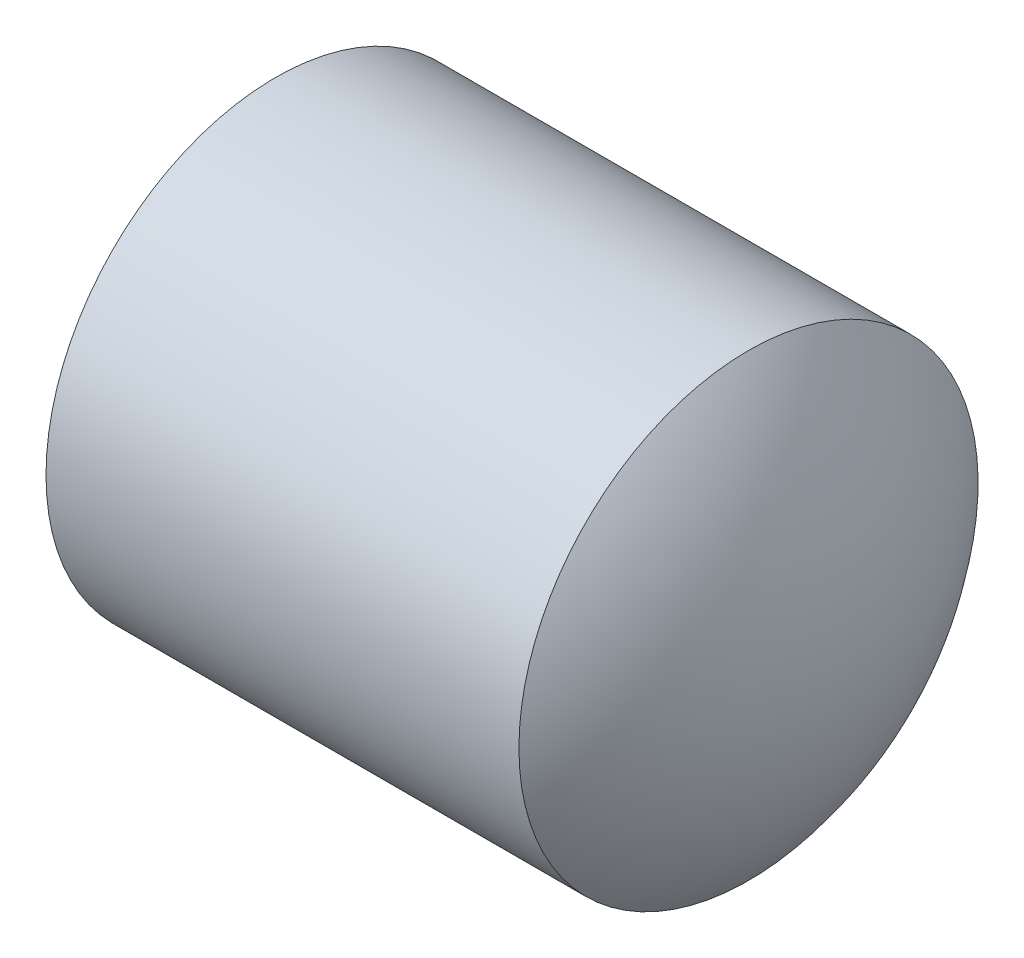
SolidWorks part; units mm, degrees
ref_plane "Plane1" through (0, 0, 0) normal (0, 0, 1) x (1, 0, 0)
ref_plane "Plane2" through (0, 0, 0) normal (0, 1, 0) x (1, 0, 0)
ref_plane "Plane3" through (0, 0, 0) normal (1, 0, 0) x (0, 0, -1)
sketch "BodySke" plane through (0, 0, 0) normal (0, 0, 1) x (1, 0, 0)
  line L0 (0, 0) -> (0, 10.352)
  line L1 (0, 10.352) -> (0.9515, 12)
  line L2 (0.9515, 12) -> (25.672, 12)
  line L3 (3, 15.875) -> (3, -3.175) construction
  line L4 (30, 0) -> (0, 0)
  line L5 (-12.7, 0) -> (88.9, 0) construction
  line L8 (0, -10.352) -> (0.9515, -12) construction
  arc A0 (30, 0) -> (25.672, 12) centre (11.2, 0) ccw
  dimension "Oval_radius" = 18.8
  dimension "Length" = 30
  dimension "Diameter" = 24
  dimension "Drive_ch_ang" = 60
  dimension "Minor_dia" = 20.704
  dimension "Advance" = 3
revolve "BaseBody" add sketch "BodySke" angle 360 about L5
sketch "Sketch2" plane through (0, 0, 0) normal (-1, 0, 0) x (0, 0, 1)
  line L0 (3.4641, 6) -> (-3.4641, 6)
  line L1 (-3.4641, 6) -> (-6.9282, 0)
  line L2 (3.4641, 6) -> (6.9282, 0)
  line L3 (3.4641, -6) -> (6.9282, 0)
  line L4 (3.4641, -6) -> (-3.4641, -6)
  line L5 (-3.4641, -6) -> (-6.9282, 0)
  dimension "Hex_size" = 12
  dimension "D2" = 6
  dimension "D3" = 6
extrude "Hex" cut sketch "Sketch2" against normal blind 12
sketch "Sketch4" plane through (0, 4.7709, -0.5249) normal (-1, 0, 0) x (0, 0, 1)
  line L0 (0.5249, -4.7709) -> (10.6976, -4.7709)
  line L1 (0.5249, -4.7709) -> (6.6732, -1.2211) construction
  line L2 (0.5249, -4.7709) -> (5.6112, 4.0389)
  line L3 (8.9666, -2.6687) -> (10.2861, -1.9069)
  line L4 (6.5663, 1.4888) -> (7.8858, 2.2506)
  arc A0 (8.9666, -2.6687) -> (6.5663, 1.4888) centre (0.5249, -4.7709) ccw
  arc A1 (10.6976, -4.7709) -> (10.2861, -1.9069) centre (0.5249, -4.7709) ccw
  arc A2 (5.6112, 4.0389) -> (7.8858, 2.2506) centre (0.5249, -4.7709) cw
  circle A3 centre (0.5249, -4.7709) radius 8.6995 construction
  circle A4 centre (0.5249, -4.7709) radius 10.1727 construction
  dimension "D1" = 30
  dimension "Spline_n_dim" = 17.399
  dimension "Spline_m_dim" = 20.3454
  dimension "Spline_a_dim" = 60
  dimension "D3" = 2.4003
  dimension "Spline_p_dim" = 4.8006
extrude "Spline6" [suppressed] cut sketch "Sketch4" against normal blind 12
pattern_circular "CirPattern1" [suppressed] count 6 every 60 about axis through (-12.7, 0, 0) along (1, 0, 0)
sketch "Sketch5" plane through (0, -2.3417, -0.7053) normal (-1, 0, 0) x (0, 0, 1)
  line L0 (0.7053, 2.3417) -> (10.878, 2.3417)
  line L1 (0.7053, 2.3417) -> (5.7254, 7.3618) construction
  line L2 (0.7053, 2.3417) -> (0.7053, 12.5144)
  line L3 (8.554, 6.7959) -> (9.3926, 7.6345)
  line L4 (5.1595, 10.1904) -> (5.9981, 11.029)
  line L5 (5.1595, 10.1904) -> (8.554, 6.7959)
  arc A1 (10.878, 2.3417) -> (9.3926, 7.6345) centre (0.7053, 2.3417) ccw
  arc A2 (0.7053, 12.5144) -> (5.9981, 11.029) centre (0.7053, 2.3417) cw
  circle A3 centre (0.7053, 2.3417) radius 8.6995 construction
  circle A4 centre (0.7053, 2.3417) radius 10.1727 construction
  dimension "D1" = 45
  dimension "Spline_n_dim" = 17.399
  dimension "Spline_m_dim" = 20.3454
  dimension "Spline_a_dim" = 90
  dimension "D3" = 2.4003
  dimension "Spline_p_dim" = 4.8006
extrude "Spline4" [suppressed] cut sketch "Sketch5" against normal blind 12
pattern_circular "CirPattern2" [suppressed] count 4 every 90 about axis through (-12.7, 0, 0) along (1, 0, 0)
sketch "ThdSchSke" plane through (0, 0, 0) normal (0, 0, 1) x (1, 0, 0)
  line L0 (0.9515, -10.352) -> (-0.2025, -12)
  line L1 (0.9515, -10.352) -> (2.1054, -12)
  line L2 (2.1054, -12) -> (2.1054, -15)
  line L3 (-3.175, 0) -> (5.1513, 0) construction
  line L4 (0.9515, 12) -> (0.9515, -12) construction
  line L5 (2.1054, -15) -> (-0.2025, -15)
  line L6 (-0.2025, -15) -> (-0.2025, -12)
  dimension "Thread_minor" = 20.704
  dimension "Diameter" = 24
  dimension "SideAngle" = 55
  dimension "VeeAngle" = 70
  dimension "Overcut" = 30
revolve "ThreadSchematic" [suppressed] cut sketch "ThdSchSke" angle 360 about L3
pattern_linear "ThdSchPat" [suppressed]
equation "\"D2@Sketch2\" = \"Hex_size@Sketch2\" / 2"
equation "\"D3@Sketch2\" = \"Hex_size@Sketch2\" / 2"
equation "\"Thread_minor@ThreadCosmetic\" = \"Minor_dia@BodySke\""
equation "\"D1@Sketch4\" = \"Spline_a_dim@Sketch4\" / 2"
equation "\"D3@Sketch4\" = \"Spline_p_dim@Sketch4\" / 2"
equation "\"D2@CirPattern1\" = \"Spline_a_dim@Sketch4\""
equation "\"Num_teeth@CirPattern1\" = 360 / \"D2@CirPattern1\""
equation "\"Spline_a_dim@Sketch5\" = 90"
equation "\"Spline_p_dim@Sketch5\" = \"Spline_p_dim@Sketch4\""
equation "\"Spline_m_dim@Sketch5\" = \"Spline_m_dim@Sketch4\""
equation "\"Spline_n_dim@Sketch5\" = \"Spline_n_dim@Sketch4\""
equation "\"D1@Sketch5\" = \"Spline_a_dim@Sketch5\" / 2"
equation "\"D3@Sketch5\" = \"Spline_p_dim@Sketch5\" / 2"
equation "\"Key_eng@Spline4\" = \"Key_eng@Spline6\""
equation "\"Thread_minor@ThdSchSke\" = \"Thread_minor@ThreadCosmetic\""
equation "\"Diameter@ThdSchSke\" = \"Diameter@BodySke\""
equation "\"Overcut@ThdSchSke\" = \"Diameter@BodySke\" * 1.25"
equation "\"Num_threads@ThdSchPat\" = int( (\"Length@BodySke\" - ( ( ( \"Diameter@BodySke\" - \"Minor_dia@BodySke\" ) * 0.5 ) / tan( \"Drive_ch_ang@BodySke\" * 0.017453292 ) ) - ( \"Oval_radius@BodySke\" - sqr ( ( \"Oval_ra"
equation "\"Advance@ThdSchPat\" = (\"Length@BodySke\" - ( ( ( \"Diameter@BodySke\" - \"Minor_dia@BodySke\" ) * 0.5 ) / tan( \"Drive_ch_ang@BodySke\" * 0.017453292 ) ) - ( \"Oval_radius@BodySke\" - sqr ( ( \"Oval_radius@Body"
equation "' \"Num_threads@ThdSchPat\" = \"Num_threads@ThdSchPat\" - sgn( \"Num_threads@ThdSchPat\" - 1) '---chamfered tips only---"
